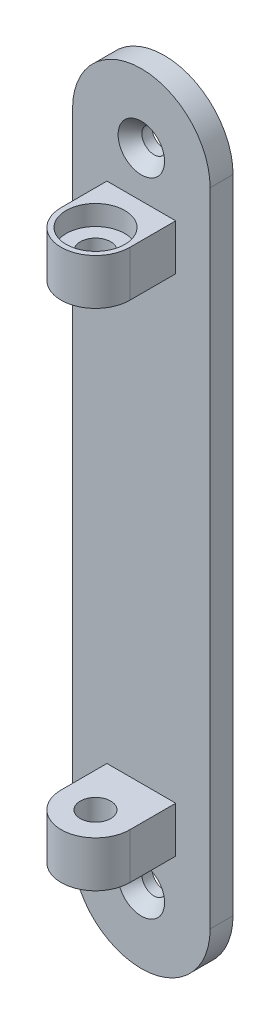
SolidWorks part; units mm, degrees
ref_plane "Front Plane" through (0, 0, 0) normal (0, 0, 1) x (1, 0, 0)
ref_plane "Top Plane" through (0, 0, 0) normal (0, 1, 0) x (1, 0, 0)
ref_plane "Right Plane" through (0, 0, 0) normal (1, 0, 0) x (0, 0, -1)
sketch "Sketch1" plane through (0, 0, 0) normal (0, 0, 1) x (1, 0, 0)
  line L0 (0, 0) -> (0, 88.9)
  line L1 (38.1, 88.9) -> (38.1, 0)
  line L2 (38.1, 0) -> (0, 0)
  arc A0 (0, 88.9) -> (38.1, 88.9) centre (19.05, 88.9) cw
  dimension "D1" = 19.05
  dimension "D2" = 88.9
extrude "Extrude1" add sketch "Sketch1" along normal blind 6.35
hole_wizard "CSK for 1/4 Flat Head Machine Screw1" positions "Sketch5" profile "Sketch4" countersink size "1/4" standard "Ansi Inch"
sketch "Sketch5" plane through (0, 0, 6.35) normal (0, 0, 1) x (1, 0, 0)
  arc A0 (38.1, 88.9) -> (0, 88.9) centre (19.05, 88.9) ccw construction
  point P0 (19.05, 88.9)
sketch "Sketch4" plane through (19.05, 88.9, 6.35) normal (1, 0, 0) x (0, -1, 0)
  line L0 (0, 0) -> (0, 6.35)
  line L1 (0, 6.35) -> (3.3782, 6.35)
  line L2 (3.3782, 6.35) -> (3.3782, 3.5209)
  line L3 (3.3782, 3.5209) -> (6.4389, 0)
  line L5 (6.4389, 0) -> (0, 0)
  line L6 (-3.3782, 3.5209) -> (-6.4389, 0) construction
  line L11 (0, -6.35) -> (0, 107.95) construction
  dimension "Thru Hole Dia." = 6.7564
  dimension "Thru Hole Depth" = 6.35
  dimension "Near C'Sink Dia." = 12.8778
  dimension "Near C'Sink Angle" = 82
sketch "Sketch6" plane through (0, 0, 6.35) normal (0, 0, 1) x (1, 0, 0)
  line L0 (0, 0) -> (38.1, 0) construction
  line L1 (9.525, 76.2) -> (28.575, 76.2)
  line L2 (9.525, 76.2) -> (9.525, 63.5)
  line L3 (9.525, 63.5) -> (28.575, 63.5)
  line L4 (28.575, 76.2) -> (28.575, 63.5)
  line L5 (19.05, 0) -> (19.05, 63.5) construction
  dimension "D1" = 12.7
  dimension "D2" = 19.05
  dimension "D3" = 63.5
extrude "Extrude2" add sketch "Sketch6" along normal blind 12.7
sketch "Sketch7" plane through (0, 76.2, 0) normal (0, 1, 0) x (-1, 0, 0)
  line L0 (-9.525, 19.05) -> (-28.575, 19.05)
  arc A0 (-9.525, 19.05) -> (-28.575, 19.05) centre (-19.05, 19.05) ccw
extrude "Extrude3" add sketch "Sketch7" against normal up to surface (12.7 mm away)
hole_wizard "CBORE for 5/16 Pan Head Machine Screw1" positions "Sketch9" profile "Sketch8" counterbore size "5/16" standard "Ansi Inch"
sketch "Sketch9" plane through (0, 76.2, 0) normal (0, 1, 0) x (-1, 0, 0)
  arc A0 (-9.525, 19.05) -> (-28.575, 19.05) centre (-19.05, 19.05) ccw construction
  point P0 (-19.05, 19.05)
sketch "Sketch8" plane through (19.05, 76.2, 19.05) normal (1, 0, 0) x (0, 0, 1)
  line L0 (0, 0) -> (0, 15.2335)
  line L1 (0, 15.2335) -> (4.2164, 12.7)
  line L2 (4.2164, 12.7) -> (4.2164, 5.5372)
  line L3 (4.2164, 5.5372) -> (8.1356, 5.5372)
  line L4 (8.1356, 5.5372) -> (8.1356, 0)
  line L5 (8.1356, 0) -> (0, 0)
  line L10 (0, 15.2335) -> (-4.2164, 12.7) construction
  line L11 (0, -6.35) -> (0, 107.95) construction
  dimension "Hole Dia." = 8.4328
  dimension "Hole Depth" = 12.7
  dimension "C'Bore Dia." = 16.2712
  dimension "C'Bore Depth" = 5.5372
  dimension "Drill Angle" = 118
mirror "Mirror1" about plane through (38.1, 0, 6.35) normal (0, 1, 0)
